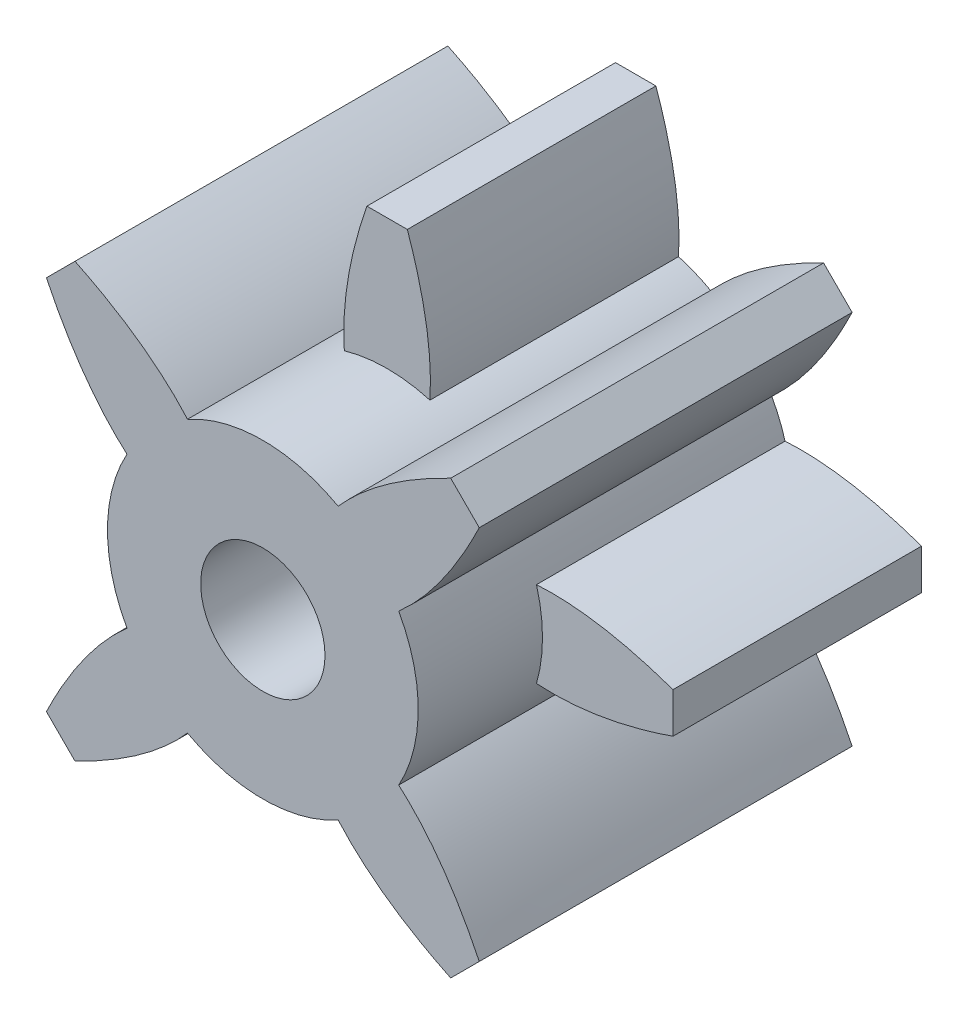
SolidWorks part; units mm, degrees
ref_plane "前基準面" through (0, 0, 0) normal (0, 0, 1) x (1, 0, 0)
ref_plane "上基準面" through (0, 0, 0) normal (0, 1, 0) x (1, 0, 0)
ref_plane "右基準面" through (0, 0, 0) normal (1, 0, 0) x (0, 0, -1)
sketch "草圖1" plane through (0, 0, 0) normal (0, 0, 1) x (1, 0, 0)
  line L0 (0, 0) -> (0, 50) construction
  line L1 (0, 0) -> (7.8217, 49.3844) construction
  line L2 (0, 0) -> (-7.8217, 49.3844) construction
  line L3 (0, 0) -> (-2.0673, 39.4459) construction
  line L4 (0, 0) -> (2.0673, 39.4459) construction
  line L5 (-6.6046, 49.5619) -> (-7.8217, 49.3844)
  line L6 (6.6046, 49.5619) -> (7.8217, 49.3844)
  circle A0 centre (0, 0) radius 7
  circle A1 centre (0, 0) radius 39.5
  circle A2 centre (0, 0) radius 45 construction
  circle A3 centre (0, 0) radius 50 construction
  spline S0 degree 2 poles (-2.0673, 39.4459) (-2.9737, 45.6922) (-6.6046, 49.5619) knots 0 0 0 1 1 1
  spline S1 degree 2 poles (2.0673, 39.4459) (2.9737, 45.6922) (6.6046, 49.5619) knots 0 0 0 1 1 1
  dimension "D1" = 100
  dimension "D2" = 90
  dimension "D3" = 79
  dimension "D4" = 14
  dimension "D5" = 18
  dimension "D6" = 6
  dimension "D7" = 1.23
sketch "草圖2" plane through (0, 0, 0) normal (0, 0, 1) x (1, 0, 0)
  line L0 (0, 63) -> (0, 45) construction
  line L1 (0, 63) -> (-6.8883, 46.3702) construction
  line L2 (0, 63) -> (6.8883, 46.3702) construction
  line L3 (0, 63) -> (-3.4455, 50.9842) construction
  line L4 (0, 63) -> (3.4455, 50.9842) construction
  line L5 (-1.625, 40) -> (1.625, 40)
  circle A0 centre (0, 63) radius 5
  circle A1 centre (0, 63) radius 12.5
  circle A2 centre (0, 63) radius 18 construction
  circle A3 centre (0, 0) radius 45 construction
  spline S0 degree 2 poles (-1.625, 40) (-3.1714, 44.905) (-3.4455, 50.9842) knots 0 0 0 1 1 1
  spline S1 degree 2 poles (1.625, 40) (3.1714, 44.905) (3.4455, 50.9842) knots 0 0 0 1 1 1
  point P14 (0, 40)
  dimension "D2" = 10
  dimension "D3" = 25
  dimension "D1" = 63
  dimension "D4" = 45
  dimension "D5" = 32
  dimension "D6" = 3.25
  dimension "D7" = 23
sketch "草圖3" plane through (0, 0, 0) normal (0, 0, 1) x (1, 0, 0)
  line L0 (-1.625, 40) -> (1.625, 40) construction
  line L1 (-1.625, 40) -> (1.625, 40)
  line L2 (-17.4125, 47.8856) -> (-15.1144, 45.5875)
  line L3 (-23, 64.625) -> (-23, 61.375)
  line L4 (-15.1144, 80.4125) -> (-17.4125, 78.1144)
  line L5 (1.625, 86) -> (-1.625, 86)
  line L6 (17.4125, 78.1144) -> (15.1144, 80.4125)
  line L7 (23, 61.375) -> (23, 64.625)
  line L8 (15.1144, 45.5875) -> (17.4125, 47.8856)
  circle A0 centre (0, 63) radius 12.5 construction
  arc A1 (-3.4455, 50.9842) -> (3.4455, 50.9842) centre (0, 63) ccw
  arc A2 (-10.9327, 56.9399) -> (-6.0601, 52.0673) centre (0, 63) ccw
  arc A3 (-12.0158, 66.4455) -> (-12.0158, 59.5545) centre (0, 63) ccw
  arc A4 (-6.0601, 73.9327) -> (-10.9327, 69.0601) centre (0, 63) ccw
  arc A5 (3.4455, 75.0158) -> (-3.4455, 75.0158) centre (0, 63) ccw
  arc A6 (10.9327, 69.0601) -> (6.0601, 73.9327) centre (0, 63) ccw
  arc A7 (12.0158, 59.5545) -> (12.0158, 66.4455) centre (0, 63) ccw
  arc A8 (6.0601, 52.0673) -> (10.9327, 56.9399) centre (0, 63) ccw
  parabola Q0 construction
  parabola Q1 construction
  parabola Q2
  parabola Q3
  parabola Q4
  parabola Q5
  parabola Q6
  parabola Q7
  parabola Q8
  parabola Q9
  parabola Q10
  parabola Q11
  parabola Q12
  parabola Q13
  parabola Q14
  parabola Q15
  parabola Q16
  parabola Q17
  point P73 (0, 63)
  dimension "D1" = 8
extrude "填料-伸長1" add sketch "草圖3" against normal blind 30
sketch "草圖4" plane through (0, 0, 0) normal (0, 0, 1) x (1, 0, 0)
  circle A0 centre (0, 63) radius 5 construction
  circle A1 centre (0, 63) radius 12.5 construction
  circle A2 centre (0, 63) radius 5
  circle A3 centre (0, 63) radius 12.5
extrude "填料-伸長2" add sketch "草圖4" against normal up to surface (30 mm away)
sketch "草圖5" plane through (0, 0, 0) normal (0, 0, 1) x (1, 0, 0)
  line L8 (-1.625, 40) -> (1.625, 40)
  line L9 (15.1144, 45.5875) -> (17.4125, 47.8856)
  line L10 (23, 61.375) -> (23, 64.625)
  line L11 (17.4125, 78.1144) -> (15.1144, 80.4125)
  line L12 (1.625, 86) -> (-1.625, 86)
  line L13 (-15.1144, 80.4125) -> (-17.4125, 78.1144)
  line L14 (-23, 64.625) -> (-23, 61.375)
  line L15 (-17.4125, 47.8856) -> (-15.1144, 45.5875)
  line L16 (-1.625, 40) -> (1.625, 40)
  line L18 (23, 61.375) -> (23, 64.625)
  line L20 (1.625, 86) -> (-1.625, 86)
  line L22 (-23, 64.625) -> (-23, 61.375)
  arc A0 (3.4455, 75.0158) -> (-3.4455, 75.0158) centre (0, 63) ccw
  arc A1 (12.0158, 59.5545) -> (12.0158, 66.4455) centre (0, 63) ccw
  arc A2 (-3.4455, 50.9842) -> (3.4455, 50.9842) centre (0, 63) ccw
  arc A3 (-12.0158, 66.4455) -> (-12.0158, 59.5545) centre (0, 63) ccw
  arc A8 (3.4455, 50.9842) -> (6.0601, 52.0673) centre (0, 63) ccw
  arc A9 (10.9327, 56.9399) -> (12.0158, 59.5545) centre (0, 63) ccw
  arc A10 (12.0158, 66.4455) -> (10.9327, 69.0601) centre (0, 63) ccw
  arc A11 (6.0601, 73.9327) -> (3.4455, 75.0158) centre (0, 63) ccw
  arc A12 (-3.4455, 75.0158) -> (-6.0601, 73.9327) centre (0, 63) ccw
  arc A13 (-10.9327, 69.0601) -> (-12.0158, 66.4455) centre (0, 63) ccw
  arc A14 (-12.0158, 59.5545) -> (-10.9327, 56.9399) centre (0, 63) ccw
  arc A15 (-6.0601, 52.0673) -> (-3.4455, 50.9842) centre (0, 63) ccw
  parabola Q16
  parabola Q17
  parabola Q18
  parabola Q19
  parabola Q20
  parabola Q21
  parabola Q22
  parabola Q23
  parabola Q24
  parabola Q25
  parabola Q26
  parabola Q27
  parabola Q28
  parabola Q29
  parabola Q30
  parabola Q31
  parabola Q32
  parabola Q33
  parabola Q36
  parabola Q37
  parabola Q40
  parabola Q41
  parabola Q44
  parabola Q45
  dimension "D1" = 0
extrude "除料-伸長1" cut sketch "草圖5" against normal blind 10
